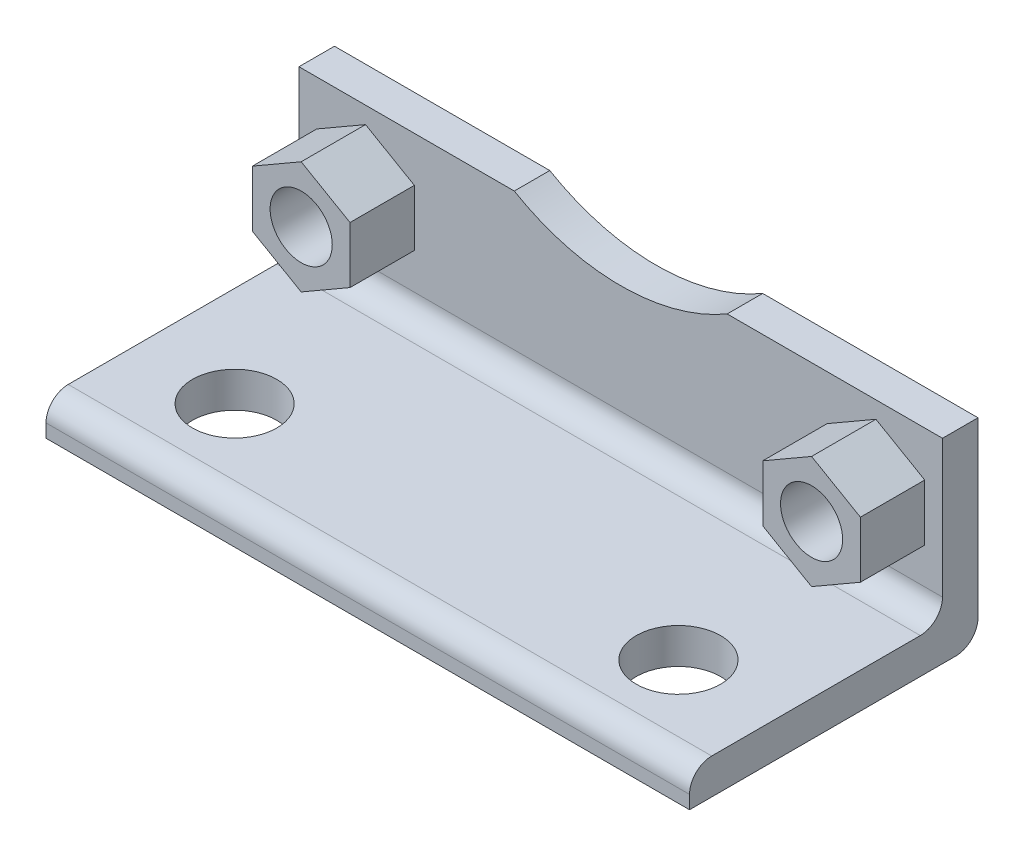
SolidWorks part; units mm, degrees
ref_plane "Front" through (0, 0, 0) normal (0, 0, 1) x (1, 0, 0)
ref_plane "Top" through (0, 0, 0) normal (0, 1, 0) x (1, 0, 0)
ref_plane "Right" through (0, 0, 0) normal (1, 0, 0) x (0, 0, -1)
sketch "Sketch1" plane through (0, 0, 0) normal (1, 0, 0) x (0, 0, -1)
  line L0 (45, -41) -> (45, -85)
  line L1 (45, -85) -> (-20, -85)
  line L2 (-20, -85) -> (-20, -77)
  line L3 (-20, -77) -> (37, -77)
  line L4 (37, -77) -> (37, -41)
  line L5 (37, -41) -> (45, -41)
  dimension "D1" = 44
  dimension "LT" = 8
  dimension "X" = 45
  dimension "Y" = 20
  dimension "LH" = 85
extrude "Base-Extrude" add sketch "Sketch1" against normal mid plane 145
sketch "Sketch2" plane through (0, -77, 0) normal (0, 1, 0) x (-1, 0, 0)
  line L0 (0, 0) -> (0, 71.623) construction
  circle A0 centre (-50, 0) radius 9.5
  circle A1 centre (50, 0) radius 9.5
  dimension "LD" = 19
  dimension "LX" = 100
extrude "Mounts" cut sketch "Sketch2" against normal through all
sketch "Sketch3" plane through (0, 0, -37) normal (0, 0, 1) x (1, 0, 0)
  line L0 (0, 0) -> (0, 59.3842) construction
  line L1 (0, 0) -> (136.2372, 0) construction
  circle A0 centre (57.5, -57.5) radius 7
  circle A1 centre (-57.5, -57.5) radius 7
  dimension "J" = 14
  dimension "C1" = 115
  dimension "C2" = 115
extrude "BodyMounts" cut sketch "Sketch3" against normal through all
sketch "Sketch4" plane through (0, 0, -37) normal (0, 0, 1) x (1, 0, 0)
  line L1 (57.5, -70.2017) -> (68.5, -63.8509)
  line L2 (68.5, -63.8509) -> (68.5, -51.1491)
  line L3 (68.5, -51.1491) -> (57.5, -44.7983)
  line L4 (57.5, -44.7983) -> (46.5, -51.1491)
  line L5 (46.5, -51.1491) -> (46.5, -63.8509)
  line L6 (46.5, -63.8509) -> (57.5, -70.2017)
  line L7 (-57.5, -70.2017) -> (-46.5, -63.8509)
  line L8 (-46.5, -63.8509) -> (-46.5, -51.1491)
  line L9 (-46.5, -51.1491) -> (-57.5, -44.7983)
  line L10 (-57.5, -44.7983) -> (-68.5, -51.1491)
  line L11 (-68.5, -51.1491) -> (-68.5, -63.8509)
  line L12 (-68.5, -63.8509) -> (-57.5, -70.2017)
  circle A0 centre (57.5, -57.5) radius 11 construction
  circle A1 centre (-57.5, -57.5) radius 11 construction
  circle A2 centre (-57.5, -57.5) radius 7 construction
  circle A3 centre (57.5, -57.5) radius 7 construction
  circle A4 centre (-57.5, -57.5) radius 7
  circle A5 centre (57.5, -57.5) radius 7
  dimension "D1" = 22
extrude "Nuts" add sketch "Sketch4" along normal blind 14.5
fillet "Fillet1" radius 5 3 edges at (0, -77, 20) (0, -77, -37) (0, -85, -45)
sketch "Sketch5" plane through (0, 0, -37) normal (0, 0, 1) x (1, 0, 0)
  circle A1 centre (0, 0) radius 47.5
  dimension "D1" = 95
extrude "Cut-Extrude1" cut sketch "Sketch5" against normal through all
